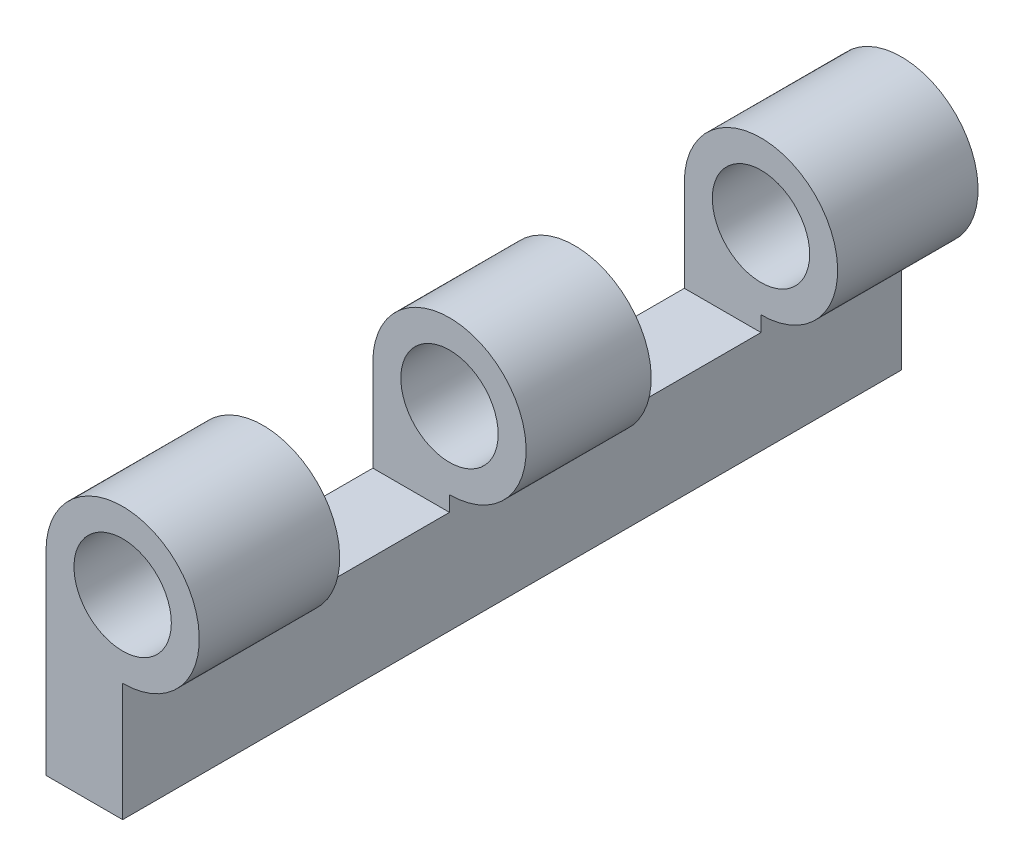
SolidWorks part; units mm, degrees
ref_plane "Front" through (0, 0, 0) normal (0, 0, 1) x (1, 0, 0)
ref_plane "Top" through (0, 0, 0) normal (0, 1, 0) x (1, 0, 0)
ref_plane "Right" through (0, 0, 0) normal (1, 0, 0) x (0, 0, -1)
sketch "Sketch1" plane through (0, 0, 0) normal (0, 0, 1) x (1, 0, 0)
  line L0 (0, 0) -> (0, 12.7)
  dimension "D1" = 12.7
extrude "Extrude-Thin1" add sketch "Sketch1" along normal mid plane 50.8 thin
sketch "Sketch2" plane through (0, 0, 25.4) normal (0, 0, 1) x (1, 0, 0)
  circle A0 centre (5, 12.7) radius 5
sweep "Sweep1" add profiles "Sketch2"
sketch "Sketch3" plane through (0, 0, 25.4) normal (0, 0, 1) x (1, 0, 0)
  circle A0 centre (5, 12.7) radius 3.175
  dimension "D1" = 6.35
extrude "Cut-Extrude1" cut sketch "Sketch3" against normal through all
sketch "Layout for cuts" plane through (5, 0, 0) normal (1, 0, 0) x (0, 0, -1)
  line L1 (25.4, 7.7) -> (25.4, 17.7) construction
  line L2 (-25.4, 6.7) -> (25.4, 6.7)
  line L3 (-25.4, 6.7) -> (25.4, 6.7)
  line L4 (-25.4, 17.7) -> (-25.4, 7.7) construction
  line L5 (25.4, 6.7) -> (25.4, 17.7)
  line L6 (-25.4, 17.7) -> (-25.4, 6.7)
  line L7 (-25.4, 17.7) -> (25.4, 17.7)
  line L8 (-15.24, 17.7) -> (-15.24, 6.7)
  line L9 (-5.08, 17.7) -> (-5.08, 6.7)
  line L10 (0, 107.8047) -> (0, 0) construction
  line L11 (5.08, 17.7) -> (5.08, 6.7)
  line L12 (15.24, 17.7) -> (15.24, 6.7)
sketch "Sketch10" plane through (5, 0, 0) normal (1, 0, 0) x (0, 0, -1)
  line L0 (-25.4, 6.7) -> (25.4, 6.7) construction
  line L2 (-25.4, 17.7) -> (25.4, 17.7) construction
  line L4 (-16.24, 6.7) -> (-4.08, 6.7)
  line L6 (-16.24, 17.7) -> (-4.08, 17.7)
  line L8 (4.08, 6.7) -> (16.24, 6.7)
  line L9 (4.08, 17.7) -> (16.24, 17.7)
  line L10 (-16.24, 17.7) -> (-16.24, 6.7)
  line L11 (-16.24, 17.7) -> (-16.24, 6.7)
  line L13 (16.24, 17.7) -> (16.24, 6.7)
  line L14 (16.24, 17.7) -> (16.24, 6.7)
  line L16 (-4.08, 17.7) -> (-4.08, 6.7)
  line L17 (-4.08, 17.7) -> (-4.08, 6.7)
  line L19 (4.08, 17.7) -> (4.08, 6.7)
  line L20 (4.08, 17.7) -> (4.08, 6.7)
  dimension "D1" = 1
  dimension "D2" = 1
  dimension "D3" = 1
  dimension "D4" = 1
extrude "2Cuts" cut sketch "Sketch10" against normal through all and the other way through all
sketch "Sketch7" plane through (5, 0, 0) normal (1, 0, 0) x (0, 0, -1)
  line L0 (-25.4, 6.7) -> (25.4, 6.7) construction
  line L1 (25.4, 6.7) -> (25.4, 17.7) construction
  line L2 (-25.4, 17.7) -> (25.4, 17.7) construction
  line L3 (-25.4, 17.7) -> (-25.4, 6.7) construction
  line L4 (25.4, 7.7) -> (16.24, 7.7)
  line L5 (-25.4, 7.7) -> (-25.4, 0)
  line L6 (-25.4, 0) -> (25.4, 0)
  line L7 (25.4, 0) -> (25.4, 7.7)
  line L8 (25.4, 7.7) -> (16.24, 7.7)
  line L9 (-25.4, 7.7) -> (-25.4, 0)
  line L10 (-25.4, 0) -> (25.4, 0)
  line L11 (25.4, 0) -> (25.4, 7.7)
  line L12 (-25.4, 6.7) -> (-14.24, 6.7)
  line L13 (25.4, 6.7) -> (25.4, 17.7)
  line L14 (-25.4, 17.7) -> (-14.24, 17.7)
  line L15 (-25.4, 17.7) -> (-25.4, 6.7)
  line L18 (-14.24, 17.7) -> (-14.24, 6.7)
  line L19 (-14.24, 17.7) -> (-14.24, 6.7)
  line L21 (14.24, 17.7) -> (14.24, 6.7)
  line L22 (14.24, 17.7) -> (14.24, 6.7)
  line L24 (-6.08, 17.7) -> (-6.08, 6.7)
  line L25 (-6.08, 17.7) -> (-6.08, 6.7)
  line L26 (-6.08, 17.7) -> (6.08, 17.7)
  line L27 (6.08, 17.7) -> (6.08, 6.7)
  line L28 (6.08, 17.7) -> (6.08, 6.7)
  line L29 (-6.08, 6.7) -> (6.08, 6.7)
  line L30 (14.24, 6.7) -> (25.4, 6.7)
  line L31 (14.24, 17.7) -> (25.4, 17.7)
  line L40 (-4.08, 6.7) -> (-16.24, 6.7)
  line L41 (-4.08, 6.7) -> (-16.24, 6.7)
  line L42 (-16.24, 6.7) -> (-16.24, 7.7)
  line L43 (-16.24, 6.7) -> (-16.24, 7.7)
  line L44 (-16.24, 7.7) -> (-25.4, 7.7)
  line L45 (-16.24, 7.7) -> (-25.4, 7.7)
  line L46 (16.24, 7.7) -> (16.24, 6.7)
  line L47 (16.24, 7.7) -> (16.24, 6.7)
  line L48 (16.24, 6.7) -> (4.08, 6.7)
  line L49 (16.24, 6.7) -> (4.08, 6.7)
  line L50 (4.08, 6.7) -> (4.08, 7.7)
  line L51 (4.08, 6.7) -> (4.08, 7.7)
  line L52 (4.08, 7.7) -> (-4.08, 7.7)
  line L53 (4.08, 7.7) -> (-4.08, 7.7)
  line L54 (-4.08, 7.7) -> (-4.08, 6.7)
  line L55 (-4.08, 7.7) -> (-4.08, 6.7)
  dimension "D1" = 0
  dimension "D2" = 1
  dimension "D3" = 1
  dimension "D4" = 1
  dimension "D5" = 1
extrude "3Cuts" [suppressed] cut sketch "Sketch7" against normal through all and the other way through all contours L19 L14 L15 L8 | L28 L26 L25 M13 | L31 L22 L13 M13
equation "\"D2@Layout for cuts\"= \"D1@Extrude-Thin1\" / 5"
equation "\"D3@Layout for cuts\"= \"D1@Extrude-Thin1\" / 5"
